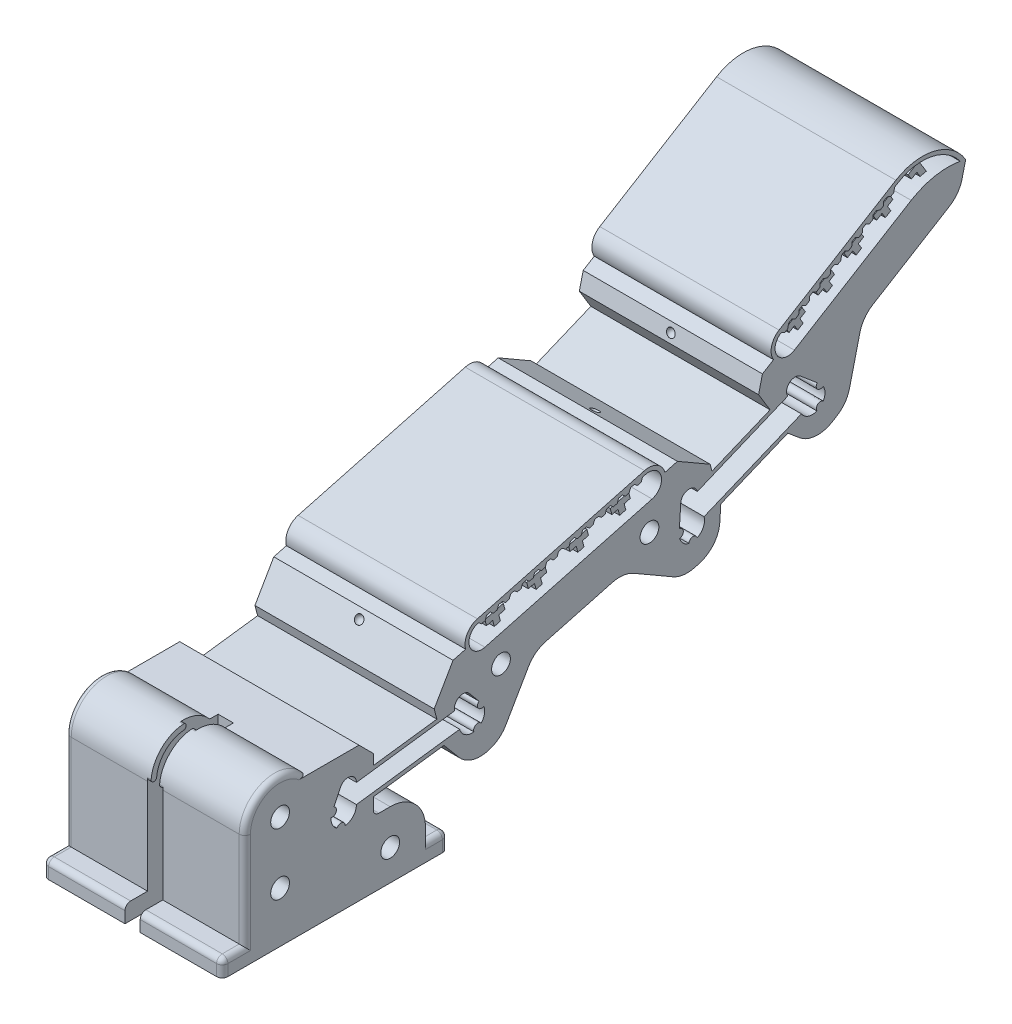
SolidWorks part; units mm, degrees
ref_plane "Front Plane" through (0, 0, 0) normal (0, 0, 1) x (1, 0, 0)
ref_plane "Top Plane" through (0, 0, 0) normal (0, 1, 0) x (1, 0, 0)
ref_plane "Right Plane" through (0, 0, 0) normal (1, 0, 0) x (0, 0, -1)
sketch "values-params_finger" plane through (0, 0, 0) normal (0, 0, 1) x (1, 0, 0)
  line L0 (0, 0) -> (62.5, 0) construction
  line L1 (0, -4.9462) -> (37.5, -4.9462) construction
  line L2 (0, -9.7143) -> (3.36, -9.7143) construction
  line L3 (0, -13.496) -> (4.5602, -13.496) construction
  line L4 (0, -17.4421) -> (12, -17.4421) construction
  line L5 (0, -21.6348) -> (12, -21.6348) construction
  line L6 (0, -25.663) -> (8, -25.663) construction
  line L7 (0, -29.4447) -> (8, -29.4447) construction
  line L8 (0, -32.88) -> (18, -32.88) construction
  line L9 (0, -36.2915) -> (31.75, -36.2915) construction
  line L10 (0, -39.8857) -> (22.75, -39.8857) construction
  line L11 (0, -43.8499) -> (22.75, -43.8499) construction
  line L12 (0, -47.895) -> (4.5, -47.895) construction
  line L13 (0, -51.6975) -> (15, -51.6975) construction
  line L14 (0, -55.9037) -> (15, -55.9037) construction
  line L15 (0, -61.7021) -> (44.45, -61.7021) construction
  dimension "Lp" = 62.5
  dimension "Ld" = 37.5
  dimension "Kp" = 3.36
  dimension "Kd" = 4.5602
  dimension "Kp Length" = 12
  dimension "Kd Length" = 12
  dimension "Rp" = 8
  dimension "Rd" = 8
  dimension "height" = 18
  dimension "depth" = 31.75
  dimension "Lb" = 22.75
  dimension "Lb Pivot" = 22.75
  dimension "pad thickness" = 4.5
  dimension "Tp" = 15
  dimension "Td" = 15
  dimension "base depth" = 44.45
inserted part "params_finger"
sketch "values-params_print" plane through (0, 0, 0) normal (0, 0, 1) x (1, 0, 0)
  line L0 (0, 0) -> (0.7, 0) construction
  line L1 (0, -5.2349) -> (3, -5.2349) construction
  line L2 (0, -10.104) -> (4, -10.104) construction
  line L3 (0, -15.1093) -> (100, -15.1093) construction
  line L4 (0, -19.837) -> (0.15, -19.837) construction
  line L5 (0, -24.2596) -> (0.3, -24.2596) construction
  line L6 (0, -28.606) -> (3.175, -28.606) construction
  line L7 (0, -33.0286) -> (9.5, -33.0286) construction
  line L8 (0, -37.6038) -> (2.4, -37.6038) construction
  line L9 (0, -43.1661) -> (6.35, -43.1661) construction
  dimension "width destroy" = 0.7
  dimension "width keep" = 3
  dimension "width tab" = 4
  dimension "base diameter" = 100
  dimension "print fit" = 0.15
  dimension "print free" = 0.3
  dimension "pin diameter" = 3.175
  dimension "pulley diameter" = 9.5
  dimension "pulley thickness" = 2.4
  dimension "base pin diameter" = 6.35
inserted part "params_print"
sketch "Sketch1" plane through (0, 0, 0) normal (0, 0, 1) x (1, 0, 0)
  line L0 (0, 0) -> (0, 9) construction
  line L1 (0, 0) -> (-15.875, 0) construction
  line L3 (-15.875, 9) -> (15.875, 9)
  line L4 (-15.875, 9) -> (-15.875, -9)
  line L5 (-15.875, -9) -> (15.875, -9)
  line L6 (15.875, 9) -> (15.875, -9)
  dimension "D1" = 31.75
  dimension "D2" = 18
extrude "Base" add sketch "Sketch1" along normal mid plane 22.75
sketch "Sketch3" plane through (15.875, 0, 0) normal (1, 0, 0) x (0, 0, -1)
  line L0 (0, 0) -> (11.375, 0) construction
  line L1 (11.375, -9) -> (11.375, 9) construction
  line L2 (11.375, 0) -> (23.2723, 1.5663) construction
  line L3 (23.2723, 1.5663) -> (72.1508, 14.6632) construction
  line L4 (72.1508, 14.6632) -> (83.2373, 19.2554) construction
  line L5 (83.2373, 19.2554) -> (110.17, 35.7093) construction
  line L6 (17.3237, 0.7832) -> (77.694, 16.9593) construction
  line L7 (77.694, 16.9593) -> (110.17, 35.7093) construction
  line L8 (11.375, 2.4005) -> (22.651, 3.8851)
  line L9 (11.375, -2.4005) -> (23.8936, -0.7524)
  line L10 (20.943, 10.2596) -> (25.6017, -7.127) construction
  line L11 (22.651, 3.8851) -> (20.943, 10.2596)
  line L12 (20.943, 10.2596) -> (69.8214, 23.3566)
  line L13 (23.8936, -0.7524) -> (25.6017, -7.127)
  line L14 (25.6017, -7.127) -> (74.4801, 5.9699)
  line L15 (69.8214, 23.3566) -> (74.4801, 5.9699) construction
  line L16 (81.6646, 21.8297) -> (84.81, 16.6812) construction
  line L17 (74.4801, 5.9699) -> (72.9287, 11.7598)
  line L18 (71.3728, 17.5667) -> (81.6646, 21.8297)
  line L19 (69.8214, 23.3566) -> (71.3728, 17.5667)
  line L20 (72.9287, 11.7598) -> (84.81, 16.6812)
  line L21 (81.6646, 21.8297) -> (78.5453, 26.9356)
  line L22 (78.5453, 26.9356) -> (105.478, 43.3895)
  line L23 (105.478, 43.3895) -> (114.862, 28.0292)
  line L24 (114.862, 28.0292) -> (87.9293, 11.5753)
  line L25 (87.9293, 11.5753) -> (84.81, 16.6812)
  line L26 (11.375, 2.4005) -> (11.375, -2.4005)
  point P9 (17.3237, 0.7832)
  point P10 (77.694, 16.9593)
  dimension "D1" = 12
  dimension "D2" = 12
  dimension "D3" = 15
  dimension "D4" = 15
  dimension "D5" = 62.5
  dimension "D6" = 37.5
  dimension "D7" = 7.5
  dimension "D8" = 7.5
  dimension "D9" = 4.76
  dimension "D10" = 18
  dimension "D11" = 5.9602
  dimension "D12" = 18
extrude "Finger Frame" add sketch "Sketch3" against normal up to surface (31.75 mm away)
sketch "Sketch29" plane through (0, 0, 0) normal (1, 0, 0) x (0, 0, -1)
  line L0 (-11.375, -9) -> (11.375, -9) construction
  line L1 (-11.375, -9) -> (11.375, -9) construction
  line L2 (-11.375, -9) -> (-11.375, -17.1005)
  line L3 (-11.375, -17.1005) -> (20.625, -17.1005)
  line L4 (20.625, -17.1005) -> (20.625, -11.6505)
  line L5 (-11.375, -9) -> (-11.375, -5.4005)
  line L6 (-11.375, -5.4005) -> (14.375, -5.4005)
  line L7 (11.375, -9) -> (11.375, -2.4005) construction
  line L8 (11.375, -9) -> (11.375, -2.4005) construction
  circle A0 centre (14.375, -11.6505) radius 6.25 construction
  circle A1 centre (14.375, -11.6505) radius 4.75 construction
  arc A2 (14.375, -5.4005) -> (20.625, -11.6505) centre (14.375, -11.6505) cw
  dimension "D2" = 9.5
  dimension "D3" = 6.25
  dimension "D4" = 5.45
  dimension "D1" = 32
  dimension "D5" = 3
extrude "Base Reroute" add sketch "Sketch29" along normal up to surface and the other way up to surface
sketch "Sketch2" plane through (15.875, 0, 0) normal (1, 0, 0) x (0, 0, -1)
  line L5 (-11.375, -17.1005) -> (-15.375, -17.1005)
  line L6 (-11.375, -17.1005) -> (-11.375, -14.1005)
  line L7 (-11.375, -14.1005) -> (-15.375, -14.1005)
  line L8 (-15.375, -17.1005) -> (-15.375, -14.1005)
  line L9 (20.625, -17.1005) -> (24.625, -17.1005)
  line L10 (20.625, -17.1005) -> (20.625, -14.1005)
  line L11 (20.625, -14.1005) -> (24.625, -14.1005)
  line L12 (24.625, -17.1005) -> (24.625, -14.1005)
  dimension "D1" = 3
  dimension "D2" = 4
extrude "Base Tabs" add sketch "Sketch2" against normal up to surface (31.75 mm away)
sketch "Sketch4" plane through (15.875, 0, 0) normal (1, 0, 0) x (0, 0, -1)
  line L0 (17.013, 3.1428) -> (17.6343, -1.5765) construction
  line L1 (22.651, 3.8851) -> (11.375, 2.4005) construction
  line L2 (11.375, -2.4005) -> (23.8936, -0.7524) construction
  line L3 (76.7948, 19.0548) -> (78.5933, 14.8639) construction
  line L4 (81.6646, 21.8297) -> (71.3728, 17.5667) construction
  line L5 (82.034, 21.225) -> (84.8057, 22.3731)
  line L6 (81.6646, 21.8297) -> (84.81, 16.6812) construction
  line L7 (71.3728, 17.5667) -> (72.9287, 11.7598) construction
  line L8 (11.375, 2.4005) -> (11.375, -2.4005) construction
  line L9 (22.651, 3.8851) -> (23.8936, -0.7524) construction
  line L10 (11.375, 1.6945) -> (22.8338, 3.2031)
  line L11 (11.375, -1.6945) -> (23.7109, -0.0704)
  line L12 (11.375, 0) -> (23.2723, 1.5663) construction
  line L13 (72.1508, 14.6632) -> (83.2373, 19.2554) construction
  line L14 (71.5555, 16.8847) -> (82.034, 21.225)
  line L15 (72.746, 12.4418) -> (84.4406, 17.2859)
  line L16 (11.375, 1.6945) -> (8.4007, 1.3029)
  line L17 (11.375, -1.6945) -> (8.4007, -2.0861)
  line L18 (5.5407, 1.9358) -> (4.1108, -1.1367)
  line L19 (8.4007, 1.3029) -> (8.4007, -2.0861) construction
  line L20 (28.4068, 4.9462) -> (30.5832, 2.3485)
  line L21 (23.7109, -0.0704) -> (26.6852, 0.3211)
  line L22 (22.8338, 3.2031) -> (25.8081, 3.5947)
  line L23 (71.5555, 16.8847) -> (68.7839, 15.7366)
  line L24 (72.746, 12.4418) -> (69.9743, 11.2938)
  line L25 (65.8378, 15.4405) -> (65.5553, 10.8497)
  line L26 (84.4406, 17.2859) -> (87.2122, 18.4339)
  line L27 (68.7839, 15.7366) -> (69.9743, 11.2938) construction
  line L28 (84.8057, 22.3731) -> (87.2122, 18.4339) construction
  line L29 (87.0523, 24.3021) -> (90.5822, 21.3275)
  arc A0 (8.4007, 1.3029) -> (5.5407, 1.9358) centre (6.9007, 1.3029) ccw
  arc A1 (8.4007, -2.0861) -> (4.1108, -1.1367) centre (6.1507, -2.0861) cw
  arc A2 (25.8081, 3.5947) -> (28.4068, 4.9462) centre (27.257, 3.9829) cw
  arc A3 (26.6852, 0.3211) -> (30.5832, 2.3485) centre (28.8586, 0.9035) ccw
  arc A4 (68.7839, 15.7366) -> (65.8378, 15.4405) centre (67.335, 15.3484) ccw
  arc A5 (69.9743, 11.2938) -> (65.5553, 10.8497) centre (67.801, 10.7114) cw
  arc A6 (84.8057, 22.3731) -> (87.0523, 24.3021) centre (86.0857, 23.1551) cw
  arc A7 (87.2122, 18.4339) -> (90.5822, 21.3275) centre (89.1323, 19.6069) ccw
  dimension "D5" = 1.5
  dimension "D6" = 2.25
  dimension "D1" = 0.7
  dimension "D2" = 0.7
  dimension "D3" = 3
extrude "Flexures" cut sketch "Sketch4" against normal through all
sketch "Sketch5" plane through (15.875, 0, 0) normal (1, 0, 0) x (0, 0, -1)
  line L0 (4.1108, -1.1367) -> (8.4007, -2.0861) construction
  line L1 (6.2557, -1.6114) -> (5.6645, -4.2829) construction
  line L3 (17.1044, 2.4488) -> (17.543, -0.8825) construction
  line L4 (25.8081, 3.5947) -> (8.4007, 1.3029) construction
  line L5 (8.4007, -2.0861) -> (26.6852, 0.3211) construction
  line L6 (69.9743, 11.2938) -> (65.5553, 10.8497) construction
  line L7 (87.2122, 18.4339) -> (90.5822, 21.3275) construction
  line L8 (88.8972, 19.8807) -> (90.598, 17.8999) construction
  line L9 (67.7648, 11.0717) -> (68.026, 8.4727) construction
  arc A0 (4.1108, -1.1367) -> (8.4007, -2.0861) centre (6.1507, -2.0861) ccw construction
  circle A1 centre (5.6645, -4.2829) radius 0.75
  circle A2 centre (4.1108, -1.1367) radius 0.75
  circle A3 centre (29.8968, -1.0927) radius 0.75
  circle A4 centre (30.5832, 2.3485) radius 0.75
  arc A5 (87.2122, 18.4339) -> (90.5822, 21.3275) centre (89.1323, 19.6069) ccw construction
  arc A6 (65.5553, 10.8497) -> (69.9743, 11.2938) centre (67.801, 10.7114) ccw construction
  circle A7 centre (68.026, 8.4727) radius 0.75
  circle A8 centre (65.5553, 10.8497) radius 0.75
  circle A9 centre (90.598, 17.8999) radius 0.75
  circle A10 centre (90.5822, 21.3275) radius 0.75
  dimension "D1" = 1.5
  dimension "D2" = 1.5
extrude "Flexure Anchors" add sketch "Sketch5" against normal up to surface (31.75 mm away)
sketch "Sketch6" plane through (15.875, 0, 0) normal (1, 0, 0) x (0, 0, -1)
  line L0 (22.7126, 3.6551) -> (60.3009, 13.7269) construction
  line L1 (69.8214, 23.3566) -> (20.943, 10.2596) construction
  line L2 (25.6017, -7.127) -> (74.4801, 5.9699) construction
  line L3 (45.3822, 16.8081) -> (50.0409, -0.5786) construction
  line L4 (22.1665, 5.6935) -> (20.943, 10.2596)
  line L5 (33.2091, 5.3055) -> (19.4934, 13.2243) construction
  line L6 (30.1016, 2.9234) -> (28.4068, 4.9462) construction
  line L7 (22.1665, 5.6935) -> (25.5091, 11.4831)
  line L8 (20.943, 10.2596) -> (22.651, 3.8851) construction
  line L9 (20.943, 10.2596) -> (25.5091, 11.4831)
  line L10 (71.0449, 18.7904) -> (69.8214, 23.3566)
  line L11 (69.8214, 23.3566) -> (65.2552, 22.1331)
  line L12 (71.0449, 18.7904) -> (65.2552, 22.1331)
  line L13 (69.8214, 23.3566) -> (78.5453, 26.9356) construction
  line L14 (74.1833, 25.1461) -> (76.5187, 19.6982) construction
  line L15 (81.6646, 21.8297) -> (71.3728, 17.5667) construction
  line L16 (78.5453, 26.9356) -> (79.6251, 25.1682)
  line L17 (78.5453, 26.9356) -> (81.6646, 21.8297) construction
  line L18 (79.6251, 25.1682) -> (80.3127, 28.0154)
  line L19 (105.478, 43.3895) -> (78.5453, 26.9356) construction
  line L20 (80.3127, 28.0154) -> (78.5453, 26.9356)
  line L21 (-11.375, -14.1005) -> (-11.375, 9) construction
  line L22 (-11.375, 9) -> (11.375, 9) construction
  line L23 (-11.375, 2.75) -> (-11.375, 9)
  line L24 (-11.375, 9) -> (-5.125, 9)
  line L25 (17.013, 3.1428) -> (17.543, -0.8825) construction
  line L26 (22.651, 3.8851) -> (11.375, 2.4005) construction
  line L27 (8.4007, -2.0861) -> (26.6852, 0.3211) construction
  line L28 (11.375, 4.2728) -> (11.375, 9)
  line L29 (11.375, 4.2728) -> (6.6478, 9)
  line L30 (11.375, 9) -> (6.6478, 9)
  line L31 (17.278, 1.1302) -> (30.1808, 2.8288) construction
  line L32 (65.6236, 11.9596) -> (89.8102, 21.978) construction
  line L33 (65.8378, 15.4405) -> (65.6013, 11.5982) construction
  line L34 (90.0086, 21.8108) -> (87.0523, 24.3021) construction
  line L35 (69.9743, 11.2938) -> (87.2122, 18.4339) construction
  line L36 (84.8057, 22.3731) -> (68.7839, 15.7366) construction
  line L37 (-5.125, 2.75) -> (-5.125, -8.15) construction
  circle A0 centre (34.0028, 6.6803) radius 1.5875
  circle A1 centre (14.375, -11.6505) radius 1.5875
  circle A2 centre (60.3009, 13.7269) radius 1.5875
  circle A3 centre (-5.125, 2.75) radius 6.25 construction
  circle A4 centre (-5.125, 2.75) radius 4.75 construction
  circle A5 centre (-5.125, 2.75) radius 1.5875
  arc A6 (-5.125, 9) -> (-11.375, 2.75) centre (-5.125, 2.75) ccw
  circle A7 centre (-5.125, -8.15) radius 1.5875
  point P73 (24.7591, 10.1841)
  point P77 (79.9606, 26.5573)
  dimension "D1" = 3.175
  dimension "D2" = 8
  dimension "D5" = 12.5
  dimension "D6" = 3.175
  dimension "D7" = 9.5
  dimension "D11" = 3.175
  dimension "D12" = 3.175
  dimension "D3" = 45
  dimension "D4" = 1.5
  dimension "D8" = 1.5
  dimension "D9" = 8
  dimension "D10" = 6.8375
  dimension "D13" = 10.9
extrude "Pin Holes" cut sketch "Sketch6" against normal through all
sketch "Sketch8" plane through (0, -8.175, -14.1595) normal (0, 0.5, 0.866) x (1, 0, 0)
  line L0 (0, 22.6992) -> (0, 16.0139) construction
  line L1 (15.875, 22.6992) -> (-15.875, 22.6992) construction
  line L2 (-15.875, 16.0139) -> (15.875, 16.0139) construction
  circle A0 centre (0, 21.1992) radius 0.75
  dimension "D1" = 1.5
  dimension "D2" = 1.5
extrude "Tendon Route 1" cut sketch "Sketch8" against normal blind 0.75
sketch "Sketch9" plane through (0, -16.784, -69.4927) normal (0, 0.2348, 0.9721) x (1, 0, 0)
  line L0 (0, 46.0875) -> (0, 43.1584) construction
  line L1 (15.875, 46.0875) -> (-15.875, 46.0875) construction
  line L2 (-15.875, 43.1584) -> (15.875, 43.1584) construction
  circle A0 centre (0, 44.5875) radius 0.75
  dimension "D1" = 1.5
  dimension "D2" = 1.5
extrude "Tendon Route 2" cut sketch "Sketch9" against normal blind 0.75
sketch "Sketch10" plane through (0, 44.8562, -25.8977) normal (0, 0.866, -0.5) x (1, 0, 0)
  line L0 (0, 45.4462) -> (0, 52.1315) construction
  line L1 (-15.875, 45.4462) -> (15.875, 45.4462) construction
  line L2 (15.875, 52.1315) -> (-15.875, 52.1315) construction
  circle A0 centre (0, 46.9462) radius 0.75
  dimension "D1" = 1.5
  dimension "D2" = 1.5
extrude "Tendon Route 3" cut sketch "Sketch10" against normal blind 0.75
sketch "Sketch11" plane through (15.875, 0, 0) normal (1, 0, 0) x (0, 0, -1)
  line L0 (-0.3647, 6.8) -> (-5.125, 6.8) construction
  line L1 (11.375, 9) -> (-5.125, 9)
  line L2 (11.375, 9) -> (11.375, 6.8)
  line L3 (11.375, 6.8) -> (-0.3647, 6.8)
  line L5 (11.375, 2.4005) -> (11.375, 4.2728) construction
  line L6 (-5.125, 9) -> (6.6478, 9) construction
  circle A0 centre (-5.125, 2.75) radius 4.75 construction
  circle A1 centre (-5.125, 2.75) radius 4.05 construction
  arc A2 (-5.125, 9) -> (-0.3647, 6.8) centre (-5.125, 2.75) cw
  dimension "D1" = 9.5
  dimension "D2" = 0.7
extrude "Tendon Clearance" cut sketch "Sketch11" against normal through all
fillet "Tendon Route Ports" radius 0.75 3 edges at (0, 21.1086, -65.5298) (0, 25.6522, -80.5135) (0, 9.1596, -25.0336)
sketch "Sketch13" plane through (15.875, 0, 0) normal (1, 0, 0) x (0, 0, -1)
  line L0 (29.8167, 15.6914) -> (59.4206, 23.6238)
  line L1 (65.2552, 22.1331) -> (25.5091, 11.4831) construction
  line L2 (27.7307, 12.0784) -> (63.0336, 21.5378)
  line L3 (83.2549, 33.2698) -> (103.94, 45.9069)
  line L4 (105.478, 43.3895) -> (80.3127, 28.0154) construction
  line L5 (29.8167, 15.6914) -> (30.5802, 12.8419) construction
  line L6 (83.2549, 33.2698) -> (84.7928, 30.7524) construction
  line L7 (114.862, 28.0292) -> (105.478, 43.3895) construction
  line L8 (82.2755, 29.2145) -> (105.478, 43.3895)
  line L9 (105.478, 43.3895) -> (113.3241, 30.5466)
  arc A0 (27.7307, 12.0784) -> (29.8167, 15.6914) centre (30.5802, 12.8419) cw
  arc A1 (63.0336, 21.5378) -> (59.4206, 23.6238) centre (60.1841, 20.7743) ccw
  arc A2 (82.2755, 29.2145) -> (83.2549, 33.2698) centre (84.7928, 30.7524) cw
  arc A3 (103.94, 45.9069) -> (113.3241, 30.5466) centre (108.632, 38.2267) cw
  dimension "D2" = 9
  dimension "D1" = 2.95
  dimension "D3" = 2.3
  dimension "D4" = 2.3
  dimension "D5" = 2.3
extrude "Finger Pad Outline" add sketch "Sketch13" against normal up to surface (31.75 mm away)
sketch "Sketch12" plane through (15.875, 0, 0) normal (1, 0, 0) x (0, 0, -1)
  line L0 (23.8936, -0.7524) -> (28.5685, -6.3321)
  line L1 (25.6017, -7.127) -> (74.4801, 5.9699) construction
  line L2 (72.9287, 11.7598) -> (72.5404, 5.4502)
  line L3 (84.81, 16.6812) -> (89.6335, 12.6164)
  line L4 (87.9293, 11.5753) -> (114.862, 28.0292) construction
  line L5 (90.0086, 21.8108) -> (87.0523, 24.3021) construction
  line L6 (65.8378, 15.4405) -> (65.6013, 11.5982) construction
  line L7 (30.1016, 2.9234) -> (28.4068, 4.9462) construction
  line L8 (23.8936, -0.7524) -> (25.6017, -7.127)
  line L9 (25.6017, -7.127) -> (28.5685, -6.3321)
  line L10 (72.9287, 11.7598) -> (74.4801, 5.9699)
  line L11 (74.4801, 5.9699) -> (72.5404, 5.4502)
  line L12 (84.81, 16.6812) -> (87.9293, 11.5753)
  line L13 (87.9293, 11.5753) -> (89.6335, 12.6164)
  line L14 (25.8081, 3.5947) -> (26.6852, 0.3211) construction
  line L15 (68.7839, 15.7366) -> (69.9743, 11.2938) construction
  line L16 (26.2467, 1.9579) -> (69.3791, 13.5152) construction
  line L17 (59.4206, 23.6238) -> (29.8167, 15.6914) construction
  line L18 (55.7266, 9.857) -> (69.3791, 13.5152) construction
  line L19 (44.6187, 19.6576) -> (50.0409, -0.5786) construction
  line L20 (86.0089, 20.4035) -> (98.0703, 27.7721) construction
  line L21 (95.2366, 16.0395) -> (98.0703, 27.7721)
  line L22 (33.8121, -4.9271) -> (39.8992, 5.6161)
  line L23 (22.1665, 5.6935) -> (25.5091, 11.4831) construction
  line L24 (39.8992, 5.6161) -> (55.7266, 9.857)
  line L25 (33.8121, -4.9271) -> (66.2698, 3.77)
  line L26 (66.2698, 3.77) -> (55.7266, 9.857)
  line L27 (28.5685, -6.3321) -> (33.8121, -4.9271) construction
  line L28 (98.0703, 27.7721) -> (115.1783, 38.2238)
  line L29 (116.3122, 42.9188) -> (122.5422, 32.7212)
  line L30 (122.5422, 32.7212) -> (95.2366, 16.0395)
  line L31 (115.1783, 38.2238) -> (116.3122, 42.9188)
  line L32 (79.6251, 25.1682) -> (80.3127, 28.0154) construction
  line L33 (84.8057, 22.3731) -> (87.2122, 18.4339) construction
  line L34 (86.0089, 20.4035) -> (118.0927, 40.0043) construction
  arc A1 (113.3241, 30.5466) -> (103.94, 45.9069) centre (108.632, 38.2267) ccw construction
  point P51 (47.8129, 7.7365)
  dimension "D1" = 8.5
extrude "Finger Outline" cut sketch "Sketch12" against normal through all
sketch "Sketch14" plane through (15.875, 0, 0) normal (1, 0, 0) x (0, 0, -1)
  line L1 (44.6187, 19.6576) -> (47.8129, 7.7365) construction
  line L2 (59.4206, 23.6238) -> (29.8167, 15.6914) construction
  line L3 (55.7266, 9.857) -> (39.8992, 5.6161) construction
  line L5 (29.9979, 15.0153) -> (59.6018, 22.9476)
  line L6 (31.1626, 10.6686) -> (60.7665, 18.601)
  line L7 (103.94, 45.9069) -> (106.651, 41.4695) construction
  line L8 (116.3122, 42.9188) -> (90.0462, 26.8721) construction
  line L9 (103.94, 45.9069) -> (83.2549, 33.2698) construction
  line L10 (83.6198, 32.6725) -> (104.305, 45.3096)
  line L11 (85.9658, 28.8324) -> (106.651, 41.4695)
  circle A0 centre (30.5802, 12.8419) radius 2.25 construction
  circle A2 centre (60.1841, 20.7743) radius 2.25 construction
  arc A3 (29.9979, 15.0153) -> (31.1626, 10.6686) centre (30.5802, 12.8419) ccw
  arc A4 (59.6018, 22.9476) -> (60.7665, 18.601) centre (60.1841, 20.7743) cw
  circle A5 centre (84.7928, 30.7524) radius 2.25 construction
  arc A7 (83.6198, 32.6725) -> (85.9658, 28.8324) centre (84.7928, 30.7524) ccw
  arc A8 (104.305, 45.3096) -> (115.3247, 43.1358) centre (108.632, 38.2267) cw
  arc A9 (106.651, 41.4695) -> (115.3247, 43.1358) centre (113.2105, 30.7324) cw
  arc A12 (29.8167, 15.6914) -> (27.7307, 12.0784) centre (30.5802, 12.8419) ccw construction
  arc A13 (29.8167, 15.6914) -> (27.7307, 12.0784) centre (30.5802, 12.8419) ccw construction
  dimension "D1" = 0.7
  dimension "D2" = 0.7
extrude "Finger Pad Cavity" cut sketch "Sketch14" against normal through all and the other way through all contours A4 L5 A3 L6 | L11 A9 A8 L10 A7
sketch "Sketch15" plane through (0, 0, 0) normal (1, 0, 0) x (0, 0, -1)
  line L0 (33.592, 8.2137) -> (59.89, 15.2603)
  line L1 (69.9743, 11.2938) -> (68.7839, 15.7366) construction
  line L2 (32.7024, 5.7698) -> (36.6955, 0.0671)
  line L3 (39.8992, 5.6161) -> (33.8121, -4.9271) construction
  line L5 (46.741, 11.737) -> (48.9855, 3.3602) construction
  line L6 (61.8823, 13.5885) -> (61.2756, 6.6533)
  line L7 (36.6955, 0.0671) -> (61.2756, 6.6533)
  line L8 (89.759, 26.8954) -> (96.5502, 21.4783)
  line L9 (89.9213, 29.4911) -> (110.3842, 41.9924)
  line L10 (110.3842, 41.9924) -> (118.9477, 35.1615)
  line L11 (118.9477, 35.1615) -> (96.5502, 21.4783)
  line L12 (98.0703, 27.7721) -> (95.2366, 16.0395) construction
  line L13 (106.651, 41.4695) -> (85.9658, 28.8324) construction
  line L14 (84.8057, 22.3731) -> (87.2122, 18.4339) construction
  line L17 (69.3791, 13.5152) -> (86.0089, 20.4035) construction
  line L18 (69.3791, 13.5152) -> (61.8823, 13.5885) construction
  line L19 (86.0089, 20.4035) -> (89.759, 26.8954) construction
  circle A0 centre (34.0028, 6.6803) radius 1.5875 construction
  circle A1 centre (60.3009, 13.7269) radius 1.5875 construction
  arc A3 (33.592, 8.2137) -> (32.7024, 5.7698) centre (34.0028, 6.6803) ccw
  arc A4 (59.89, 15.2603) -> (61.8823, 13.5885) centre (60.3009, 13.7269) cw
  arc A5 (89.9213, 29.4911) -> (89.759, 26.8954) centre (90.7489, 28.1364) ccw
  circle A6 centre (34.0028, 6.6803) radius 1.5875 construction
  dimension "D2" = 1.5
  dimension "D3" = 70
  dimension "D4" = 6
  dimension "D5" = 70
extrude "Back Cutaway" cut sketch "Sketch15" against normal mid plane 25.75
sketch "Sketch7" plane through (0, -17.1005, 0) normal (0, 1, 0) x (1, 0, 0)
  line L0 (0, 0) -> (0, -5.125) construction
  line L1 (15.875, -6.7125) -> (15.875, -3.5375) construction
  line L4 (-1.2, 1.125) -> (1.2, 1.125)
  line L5 (-1.2, 1.125) -> (-1.2, -15.375)
  line L6 (-1.2, -15.375) -> (1.2, -15.375)
  line L7 (1.2, 1.125) -> (1.2, -15.375)
  line L8 (0, -5.125) -> (15.875, -5.125) construction
  dimension "D1" = 2.4
  dimension "D2" = 6.25
  dimension "D3" = 10.25
extrude "Pulley Clearance 1" cut sketch "Sketch7" along normal through all
sketch "Sketch30" plane through (0, -17.1005, 0) normal (0, -1, 0) x (1, 0, 0)
  line L0 (-15.875, -24.625) -> (15.875, -24.625) construction
  line L1 (-1.2, -1.125) -> (1.2, -1.125)
  line L2 (-1.2, -1.125) -> (-1.2, -24.625)
  line L3 (-1.2, -24.625) -> (1.2, -24.625)
  line L4 (1.2, -1.125) -> (1.2, -24.625)
  line L5 (1.2, -1.125) -> (1.2, 15.375) construction
extrude "Pulley Clearance 2" cut sketch "Sketch30" against normal up to surface (11.7 mm away)
sketch "Sketch16" plane through (15.875, 0, 0) normal (1, 0, 0) x (0, 0, -1)
  line L0 (-11.375, 2.75) -> (-5.125, 2.75) construction
  line L1 (-5.125, 2.75) -> (-5.125, 9) construction
  line L2 (-11.375, 2.75) -> (-10.375, 2.75)
  line L3 (-5.125, 9) -> (-5.125, 8)
  line L4 (14.375, -5.4005) -> (14.375, -11.6505) construction
  line L5 (14.375, -11.6505) -> (20.625, -11.6505) construction
  line L6 (14.375, -5.4005) -> (14.375, -6.4005)
  line L7 (19.625, -11.6505) -> (20.625, -11.6505)
  arc A0 (-11.375, 2.75) -> (-5.125, 9) centre (-5.125, 2.75) cw
  arc A1 (-0.3647, 6.8) -> (-11.375, 2.75) centre (-5.125, 2.75) ccw construction
  arc A2 (-5.125, 8) -> (-10.375, 2.75) centre (-5.125, 2.75) ccw
  arc A3 (20.625, -11.6505) -> (14.375, -5.4005) centre (14.375, -11.6505) ccw construction
  arc A4 (20.625, -11.6505) -> (14.375, -5.4005) centre (14.375, -11.6505) ccw
  arc A5 (14.375, -6.4005) -> (19.625, -11.6505) centre (14.375, -11.6505) cw
  dimension "D1" = 1
  dimension "D2" = 1
extrude "Pulley Cover" add sketch "Sketch16" against normal up to surface (31.75 mm away)
sketch "Sketch17" plane through (0, -17.1005, 0) normal (0, -1, 0) x (1, 0, 0)
  line L0 (0, 0) -> (0, 24.5637) construction
  line L1 (-1.2, -1.125) -> (1.2, -1.125) construction
  line L3 (-1.2, -1.125) -> (1.2, -1.125) construction
  line L4 (-15.875, 15.375) -> (-1.2, 15.375) construction
  line L5 (-0.75, -1.125) -> (0.75, -1.125)
  line L6 (-0.75, -1.125) -> (-0.75, 15.375)
  line L7 (-0.75, 15.375) -> (0.75, 15.375)
  line L8 (0.75, -1.125) -> (0.75, 15.375)
  line L9 (1.2, 15.375) -> (15.875, 15.375) construction
  line L10 (-15.875, 15.375) -> (-1.2, 15.375) construction
  line L11 (1.2, 15.375) -> (15.875, 15.375) construction
  dimension "D1" = 1.5
extrude "Pulley Cover Cutaway 1" cut sketch "Sketch17" against normal through all
sketch "Sketch31" plane through (0, -17.1005, 0) normal (0, -1, 0) x (1, 0, 0)
  line L0 (-1.2, -20.625) -> (1.2, -20.625) construction
  line L1 (-1.2, -14.375) -> (1.2, -14.375) construction
  line L2 (-1.2, -20.625) -> (1.2, -20.625) construction
  line L3 (-1.2, -14.375) -> (1.2, -14.375) construction
  line L4 (0, -20.625) -> (0, -14.375) construction
  line L6 (0.75, -20.625) -> (-0.75, -20.625)
  line L7 (0.75, -20.625) -> (0.75, -14.375)
  line L8 (0.75, -14.375) -> (-0.75, -14.375)
  line L9 (-0.75, -20.625) -> (-0.75, -14.375)
  dimension "D1" = 1.5
extrude "Pulley Cover Cutaway 2" cut sketch "Sketch31" against normal up to surface (11.7 mm away)
sketch "Sketch18" plane through (0, 0, 0) normal (1, 0, 0) x (0, 0, -1)
  line L0 (60.7665, 18.601) -> (31.1626, 10.6686) construction
  line L1 (60.7665, 18.601) -> (31.1626, 10.6686) construction
  line L2 (59.6018, 22.9476) -> (29.9979, 15.0153) construction
  line L3 (59.6018, 22.9476) -> (29.9979, 15.0153) construction
  line L4 (44.7998, 18.9814) -> (45.9645, 14.6348) construction
  line L5 (34.5719, 12.7468) -> (34.2807, 13.8335) construction
  line L6 (29.9979, 15.0153) -> (31.1626, 10.6686) construction
  line L7 (30.5802, 12.8419) -> (45.3822, 16.8081) construction
  line L8 (37.9812, 14.825) -> (38.5635, 12.6517) construction
  line L9 (32.6507, 13.3967) -> (32.9419, 12.3101)
  line L10 (32.9419, 12.3101) -> (34.0285, 12.6012)
  line L11 (34.0285, 12.6012) -> (34.3197, 11.5146)
  line L12 (34.3197, 11.5146) -> (35.4064, 11.8057)
  line L13 (40.3429, 14.2931) -> (40.0517, 15.3798)
  line L14 (35.4064, 11.8057) -> (35.1152, 12.8924)
  line L15 (35.1152, 12.8924) -> (36.2019, 13.1836)
  line L16 (36.2019, 13.1836) -> (35.9107, 14.2702)
  line L17 (35.9107, 14.2702) -> (32.6507, 13.3967)
  line L18 (38.2724, 13.7384) -> (30.8714, 11.7553) construction
  line L19 (41.4295, 14.5843) -> (40.3429, 14.2931)
  line L20 (41.7207, 13.4977) -> (41.4295, 14.5843)
  line L21 (42.8074, 13.7888) -> (41.7207, 13.4977)
  line L22 (42.5162, 14.8755) -> (42.8074, 13.7888)
  line L23 (43.6029, 15.1667) -> (42.5162, 14.8755)
  line L24 (43.3117, 16.2533) -> (43.6029, 15.1667)
  line L25 (40.0517, 15.3798) -> (43.3117, 16.2533)
  line L26 (47.7438, 16.2762) -> (48.8305, 16.5674)
  line L27 (48.8305, 16.5674) -> (49.1217, 15.4807)
  line L28 (49.1217, 15.4807) -> (50.2083, 15.7719)
  line L29 (50.2083, 15.7719) -> (49.9172, 16.8586)
  line L30 (49.9172, 16.8586) -> (51.0038, 17.1497)
  line L31 (47.4527, 17.3629) -> (47.7438, 16.2762)
  line L32 (50.7127, 18.2364) -> (47.4527, 17.3629)
  line L33 (51.0038, 17.1497) -> (50.7127, 18.2364)
  line L34 (57.6093, 17.755) -> (56.5226, 17.4638)
  line L35 (56.2315, 18.5505) -> (55.1448, 18.2593)
  line L36 (56.5226, 17.4638) -> (56.2315, 18.5505)
  line L37 (57.3181, 18.8417) -> (57.6093, 17.755)
  line L38 (58.4048, 19.1328) -> (57.3181, 18.8417)
  line L39 (55.1448, 18.2593) -> (54.8536, 19.346)
  line L40 (54.8536, 19.346) -> (58.1136, 20.2195)
  line L41 (58.1136, 20.2195) -> (58.4048, 19.1328)
  line L42 (106.651, 41.4695) -> (85.9658, 28.8324) construction
  line L43 (104.305, 45.3096) -> (83.6198, 32.6725) construction
  line L44 (106.651, 41.4695) -> (85.9658, 28.8324) construction
  line L45 (104.305, 45.3096) -> (83.6198, 32.6725) construction
  line L46 (83.6198, 32.6725) -> (85.9658, 28.8324) construction
  line L47 (93.9624, 38.991) -> (96.3084, 35.1509) construction
  line L48 (84.7928, 30.7524) -> (95.1354, 37.071) construction
  line L49 (89.9641, 33.9117) -> (91.1371, 31.9916) construction
  line L50 (90.5506, 32.9517) -> (85.3793, 29.7924) construction
  line L51 (87.965, 31.372) -> (87.3785, 32.332) construction
  line L52 (113.2105, 30.7324) -> (110.8368, 43.0887) construction
  line L53 (110.8368, 43.0887) -> (109.4827, 45.3052)
  line L54 (85.9384, 31.4523) -> (88.8185, 33.2118)
  line L55 (88.8185, 33.2118) -> (89.405, 32.2518)
  line L56 (89.405, 32.2518) -> (88.445, 31.6653)
  line L57 (88.445, 31.6653) -> (89.0315, 30.7053)
  line L58 (89.0315, 30.7053) -> (88.0715, 30.1188)
  line L59 (88.0715, 30.1188) -> (87.485, 31.0788)
  line L60 (87.485, 31.0788) -> (86.525, 30.4923)
  line L61 (86.525, 30.4923) -> (85.9384, 31.4523)
  line L62 (91.6962, 33.6515) -> (92.6563, 34.2381)
  line L63 (92.6563, 34.2381) -> (93.2428, 33.278)
  line L64 (93.2428, 33.278) -> (94.2028, 33.8645)
  line L65 (94.2028, 33.8645) -> (93.6163, 34.8246)
  line L66 (93.6163, 34.8246) -> (94.5763, 35.4111)
  line L67 (91.1097, 34.6116) -> (91.6962, 33.6515)
  line L68 (93.9898, 36.3711) -> (91.1097, 34.6116)
  line L69 (94.5763, 35.4111) -> (93.9898, 36.3711)
  line L70 (101.4523, 40.9301) -> (102.0388, 39.9701)
  line L71 (102.0388, 39.9701) -> (102.9988, 40.5566)
  line L72 (102.9988, 40.5566) -> (103.5853, 39.5966)
  line L73 (103.5853, 39.5966) -> (104.5453, 40.1831)
  line L74 (104.5453, 40.1831) -> (103.9588, 41.1431)
  line L75 (103.9588, 41.1431) -> (104.9189, 41.7296)
  line L76 (104.9189, 41.7296) -> (104.3324, 42.6896)
  line L77 (104.3324, 42.6896) -> (101.4523, 40.9301)
  line L78 (96.8675, 36.8108) -> (96.281, 37.7708)
  line L79 (97.8275, 37.3973) -> (96.8675, 36.8108)
  line L80 (98.414, 36.4373) -> (97.8275, 37.3973)
  line L81 (99.3741, 37.0238) -> (98.414, 36.4373)
  line L82 (98.7876, 37.9838) -> (99.3741, 37.0238)
  line L83 (99.7476, 38.5703) -> (98.7876, 37.9838)
  line L84 (99.1611, 39.5304) -> (99.7476, 38.5703)
  line L85 (96.281, 37.7708) -> (99.1611, 39.5304)
  line L86 (109.4827, 45.3052) -> (107.6096, 44.1608)
  line L87 (107.6096, 44.1608) -> (108.1961, 43.2008)
  line L88 (108.1961, 43.2008) -> (109.1561, 43.7873)
  line L89 (109.1561, 43.7873) -> (109.7426, 42.8273)
  line L90 (109.7426, 42.8273) -> (110.8368, 43.0887)
  arc A0 (115.3247, 43.1358) -> (106.651, 41.4695) centre (113.2105, 30.7324) ccw construction
  arc A1 (115.3247, 43.1358) -> (106.651, 41.4695) centre (113.2105, 30.7324) ccw construction
extrude "Pad Hooks" add sketch "Sketch18" along normal mid plane 28.75
sketch "Sketch19" plane through (15.875, 0, 0) normal (1, 0, 0) x (0, 0, -1)
  line L0 (29.8167, 15.6914) -> (29.9979, 15.0153) construction
  line L1 (29.9979, 15.0153) -> (30.5329, 14.5639)
  line L2 (30.5329, 14.5639) -> (31.2091, 14.7451)
  line L3 (86.7772, 34.6014) -> (85.4972, 33.8194)
  line L4 (31.2091, 14.7451) -> (31.4468, 15.4035)
  line L5 (59.6018, 22.9476) -> (29.9979, 15.0153) construction
  line L6 (31.4468, 15.4035) -> (29.9979, 15.0153)
  line L7 (33.5718, 15.9729) -> (32.1229, 15.5847)
  line L8 (32.1229, 15.5847) -> (32.658, 15.1333)
  line L9 (32.658, 15.1333) -> (33.3341, 15.3145)
  line L10 (33.3341, 15.3145) -> (33.5718, 15.9729)
  line L11 (35.6968, 16.5423) -> (34.248, 16.1541)
  line L12 (34.248, 16.1541) -> (34.783, 15.7027)
  line L13 (34.783, 15.7027) -> (35.4592, 15.8839)
  line L14 (35.4592, 15.8839) -> (35.6968, 16.5423)
  line L15 (37.8219, 17.1117) -> (36.373, 16.7235)
  line L16 (36.373, 16.7235) -> (36.908, 16.2721)
  line L17 (36.908, 16.2721) -> (37.5842, 16.4533)
  line L18 (37.5842, 16.4533) -> (37.8219, 17.1117)
  line L19 (39.9469, 17.6811) -> (38.498, 17.2929)
  line L20 (38.498, 17.2929) -> (39.0331, 16.8415)
  line L21 (39.0331, 16.8415) -> (39.7092, 17.0227)
  line L22 (39.7092, 17.0227) -> (39.9469, 17.6811)
  line L23 (42.072, 18.2505) -> (40.6231, 17.8623)
  line L24 (40.6231, 17.8623) -> (41.1581, 17.4109)
  line L25 (41.1581, 17.4109) -> (41.8343, 17.5921)
  line L26 (41.8343, 17.5921) -> (42.072, 18.2505)
  line L27 (44.197, 18.8199) -> (42.7481, 18.4317)
  line L28 (42.7481, 18.4317) -> (43.2832, 17.9803)
  line L29 (43.2832, 17.9803) -> (43.9593, 18.1615)
  line L30 (43.9593, 18.1615) -> (44.197, 18.8199)
  line L31 (46.322, 19.3893) -> (44.8731, 19.0011)
  line L32 (44.8731, 19.0011) -> (45.4082, 18.5497)
  line L33 (45.4082, 18.5497) -> (46.0843, 18.7309)
  line L34 (46.0843, 18.7309) -> (46.322, 19.3893)
  line L35 (48.4471, 19.9587) -> (46.9982, 19.5705)
  line L36 (46.9982, 19.5705) -> (47.5332, 19.1191)
  line L37 (47.5332, 19.1191) -> (48.2094, 19.3003)
  line L38 (48.2094, 19.3003) -> (48.4471, 19.9587)
  line L39 (50.5721, 20.5281) -> (49.1232, 20.1399)
  line L40 (49.1232, 20.1399) -> (49.6583, 19.6885)
  line L41 (49.6583, 19.6885) -> (50.3344, 19.8697)
  line L42 (50.3344, 19.8697) -> (50.5721, 20.5281)
  line L43 (52.6971, 21.0975) -> (51.2482, 20.7093)
  line L44 (51.2482, 20.7093) -> (51.7833, 20.2579)
  line L45 (51.7833, 20.2579) -> (52.4594, 20.4391)
  line L46 (52.4594, 20.4391) -> (52.6971, 21.0975)
  line L47 (54.8222, 21.6669) -> (53.3733, 21.2787)
  line L48 (53.3733, 21.2787) -> (53.9083, 20.8273)
  line L49 (53.9083, 20.8273) -> (54.5845, 21.0085)
  line L50 (54.5845, 21.0085) -> (54.8222, 21.6669)
  line L67 (83.2549, 33.2698) -> (83.6198, 32.6725) construction
  line L68 (83.6198, 32.6725) -> (84.2607, 32.3908)
  line L69 (84.2607, 32.3908) -> (84.858, 32.7557)
  line L70 (84.858, 32.7557) -> (84.8999, 33.4545)
  line L71 (104.305, 45.3096) -> (83.6198, 32.6725) construction
  line L72 (84.8999, 33.4545) -> (83.6198, 32.6725)
  line L73 (85.4972, 33.8194) -> (86.138, 33.5377)
  line L74 (86.138, 33.5377) -> (86.7354, 33.9026)
  line L75 (86.7354, 33.9026) -> (86.7772, 34.6014)
  line L76 (88.6546, 35.7483) -> (87.3746, 34.9663)
  line L77 (87.3746, 34.9663) -> (88.0154, 34.6846)
  line L78 (88.0154, 34.6846) -> (88.6128, 35.0496)
  line L79 (88.6128, 35.0496) -> (88.6546, 35.7483)
  line L80 (90.532, 36.8953) -> (89.252, 36.1133)
  line L81 (89.252, 36.1133) -> (89.8928, 35.8316)
  line L82 (89.8928, 35.8316) -> (90.4901, 36.1965)
  line L83 (90.4901, 36.1965) -> (90.532, 36.8953)
  line L84 (92.4094, 38.0422) -> (91.1293, 37.2602)
  line L85 (91.1293, 37.2602) -> (91.7702, 36.9785)
  line L86 (91.7702, 36.9785) -> (92.3675, 37.3435)
  line L87 (92.3675, 37.3435) -> (92.4094, 38.0422)
  line L88 (94.2867, 39.1891) -> (93.0067, 38.4071)
  line L89 (93.0067, 38.4071) -> (93.6475, 38.1255)
  line L90 (93.6475, 38.1255) -> (94.2449, 38.4904)
  line L91 (94.2449, 38.4904) -> (94.2867, 39.1891)
  line L92 (96.1641, 40.3361) -> (94.8841, 39.5541)
  line L93 (94.8841, 39.5541) -> (95.5249, 39.2724)
  line L94 (95.5249, 39.2724) -> (96.1222, 39.6373)
  line L95 (96.1222, 39.6373) -> (96.1641, 40.3361)
  line L96 (98.0415, 41.483) -> (96.7615, 40.701)
  line L97 (96.7615, 40.701) -> (97.4023, 40.4193)
  line L98 (97.4023, 40.4193) -> (97.9996, 40.7843)
  line L99 (97.9996, 40.7843) -> (98.0415, 41.483)
  line L100 (99.9189, 42.63) -> (98.6388, 41.848)
  line L101 (98.6388, 41.848) -> (99.2796, 41.5663)
  line L102 (99.2796, 41.5663) -> (99.877, 41.9312)
  line L103 (99.877, 41.9312) -> (99.9189, 42.63)
  line L104 (101.7962, 43.7769) -> (100.5162, 42.9949)
  line L105 (100.5162, 42.9949) -> (101.157, 42.7132)
  line L106 (101.157, 42.7132) -> (101.7544, 43.0782)
  line L107 (101.7544, 43.0782) -> (101.7962, 43.7769)
  line L108 (103.6736, 44.9238) -> (102.3936, 44.1418)
  line L109 (102.3936, 44.1418) -> (103.0344, 43.8602)
  line L110 (103.0344, 43.8602) -> (103.6317, 44.2251)
  line L111 (103.6317, 44.2251) -> (103.6736, 44.9238)
  line L128 (56.9472, 22.2363) -> (55.4983, 21.8481)
  line L129 (55.4983, 21.8481) -> (56.0334, 21.3967)
  line L130 (56.0334, 21.3967) -> (56.7095, 21.5779)
  line L131 (56.7095, 21.5779) -> (56.9472, 22.2363)
  line L132 (59.0722, 22.8057) -> (57.6234, 22.4175)
  line L133 (57.6234, 22.4175) -> (58.1584, 21.9661)
  line L134 (58.1584, 21.9661) -> (58.8346, 22.1473)
  line L135 (58.8346, 22.1473) -> (59.0722, 22.8057)
  dimension "D1" = 1.5
  dimension "D3" = 0.7
  dimension "D2" = 0.7
  dimension "D4" = 1.5
  dimension "D5" = 14
  dimension "D6" = 11
extrude "Ridges" add sketch "Sketch19" against normal up to surface (31.75 mm away)
sketch "Sketch25" plane through (0, 0, 0) normal (1, 0, 0) x (0, 0, -1)
  line L24 (20.625, -11.6505) -> (19.625, -11.6505)
  line L25 (14.375, -6.4005) -> (14.375, -5.4005)
  line L26 (14.375, -5.4005) -> (11.375, -5.4005)
  line L27 (11.375, -5.4005) -> (1.125, -5.4005)
  line L28 (1.125, -5.4005) -> (1.125, 6.8)
  line L29 (1.125, 6.8) -> (-0.3647, 6.8)
  line L30 (-5.125, 9) -> (-5.125, 8)
  line L31 (-10.375, 2.75) -> (-11.375, 2.75)
  line L32 (-11.375, 2.75) -> (-11.375, -14.1005)
  line L33 (-11.375, -14.1005) -> (-15.375, -14.1005)
  line L34 (-15.375, -14.1005) -> (-15.375, -17.1005)
  line L35 (-15.375, -17.1005) -> (24.625, -17.1005)
  line L36 (24.625, -17.1005) -> (24.625, -14.1005)
  line L37 (24.625, -14.1005) -> (20.625, -14.1005)
  line L38 (20.625, -14.1005) -> (20.625, -11.6505)
  line L39 (20.625, -11.6505) -> (19.625, -11.6505)
  line L40 (14.375, -6.4005) -> (14.375, -5.4005)
  line L41 (14.375, -5.4005) -> (11.375, -5.4005)
  line L42 (11.375, -5.4005) -> (1.125, -5.4005)
  line L43 (1.125, -5.4005) -> (1.125, 6.8)
  line L44 (1.125, 6.8) -> (-0.3647, 6.8)
  line L45 (-5.125, 9) -> (-5.125, 8)
  line L46 (-10.375, 2.75) -> (-11.375, 2.75)
  line L47 (-11.375, 2.75) -> (-11.375, -14.1005)
  line L48 (-11.375, -14.1005) -> (-15.375, -14.1005)
  line L49 (-15.375, -14.1005) -> (-15.375, -17.1005)
  line L50 (-15.375, -17.1005) -> (24.625, -17.1005)
  line L51 (24.625, -17.1005) -> (24.625, -14.1005)
  line L52 (24.625, -14.1005) -> (20.625, -14.1005)
  line L53 (20.625, -14.1005) -> (20.625, -11.6505)
  arc A6 (19.625, -11.6505) -> (14.375, -6.4005) centre (14.375, -11.6505) ccw
  arc A7 (-0.3647, 6.8) -> (-5.125, 9) centre (-5.125, 2.75) ccw
  arc A8 (-5.125, 8) -> (-10.375, 2.75) centre (-5.125, 2.75) ccw
  arc A9 (19.625, -11.6505) -> (14.375, -6.4005) centre (14.375, -11.6505) ccw
  arc A10 (-0.3647, 6.8) -> (-5.125, 9) centre (-5.125, 2.75) ccw
  arc A11 (-5.125, 8) -> (-10.375, 2.75) centre (-5.125, 2.75) ccw
  dimension "D1" = 0
extrude "Clearance - Pulley" cut sketch "Sketch25" against normal mid plane 2.7
sketch "Sketch28" plane through (15.875, 0, 0) normal (1, 0, 0) x (0, 0, -1)
  circle A0 centre (-5.125, 2.75) radius 1.5875 construction
  circle A1 centre (34.0028, 6.6803) radius 1.5875 construction
  circle A2 centre (60.3009, 13.7269) radius 1.5875 construction
  circle A3 centre (-5.125, 2.75) radius 1.5875 construction
  circle A4 centre (34.0028, 6.6803) radius 1.5875 construction
  circle A5 centre (60.3009, 13.7269) radius 1.5875 construction
  circle A6 centre (-5.125, 2.75) radius 1.6625
  circle A7 centre (34.0028, 6.6803) radius 1.6625
  circle A8 centre (60.3009, 13.7269) radius 1.6625
  circle A9 centre (14.375, -11.6505) radius 1.5875 construction
  circle A10 centre (14.375, -11.6505) radius 1.5875 construction
  circle A11 centre (14.375, -11.6505) radius 1.6625
  circle A12 centre (-5.125, -8.15) radius 1.5875 construction
  circle A13 centre (-5.125, -8.15) radius 1.5875 construction
  circle A14 centre (-5.125, -8.15) radius 1.6625
  dimension "D4" = 0.075
  dimension "D5" = 0.075
  dimension "D1" = 0.075
  dimension "D2" = 0.075
  dimension "D3" = 0.075
extrude "Clearance - Pins" cut sketch "Sketch28" against normal through all
fillet "Finger Contouring" radius 5 14 edges at (14.375, 9.857, -55.7266) (-14.375, 9.857, -55.7266) (-14.375, 5.6161, -39.8992) (14.375, 5.6161, -39.8992) (0, -4.9271, -33.8121) (0, 3.77, -66.2698) (0, 16.0395, -95.2366) (0, 12.6164, -89.6335) (0, 5.4502, -72.5404) (0, -6.3321, -28.5685) (0, 41.9924, -110.3842) (0, 38.2238, -115.1783) (-14.375, 27.7721, -98.0703) (14.375, 27.7721, -98.0703)
fillet "Contouring" radius 1 20 edges at (8.6125, -14.1005, -24.625) (8.6125, -14.1005, 15.375) (8.6125, -5.4005, -11.375) (-15.875, 8.6158, 7.2827) (15.875, 8.6158, 7.2827) (-8.6125, -5.4005, -11.375) (-8.6125, -14.1005, 15.375) (15.875, -15.6005, 15.375) (-15.875, -15.6005, 15.375) (-8.6125, -14.1005, -24.625) (15.875, -15.6005, -24.625) (15.875, -14.1005, -22.625) (-15.875, -14.1005, -22.625) (-15.875, -15.6005, -24.625)
fillet "Pulley Cover Fillet" radius 0.5 11 edges at (-1.05, 2.75, 11.375) (-1.05, -6.4005, -14.375) (1.05, -6.4005, -14.375) (1.05, -5.4005, -14.375) (1.05, -11.6505, -19.625) (1.05, -11.6505, -20.625) (-1.05, -11.6505, -19.625) (1.05, 8, 5.125) (-1.05, 9, 5.125) (-1.05, 8, 5.125) (-1.05, 2.75, 10.375)
ref_point "Ref Center"
equation "\"D1@Sketch1\"=\"depth@values@params_finger.sldprt\""
equation "\"D2@Sketch1\"=\"height@values@params_finger.sldprt\""
equation "\"D1@Base\" = \"Lb@values@params_finger.sldprt\""
equation "\"D1@Sketch2\"=\"width keep@values@params_print.sldprt\""
equation "\"D2@Sketch2\"=\"width tab@values@params_print.sldprt\""
equation "\"D1@Sketch3\" = \"Kp length@values@params_finger.sldprt\""
equation "\"D2@Sketch3\" = \"Kd length@values@params_finger.sldprt\""
equation "\"D3@Sketch3\" = \"Tp@values@params_finger.sldprt\""
equation "\"D4@Sketch3\" = \"Td@values@params_finger.sldprt\""
equation "\"D5@Sketch3\" = \"Lp@values@params_finger.sldprt\""
equation "\"D6@Sketch3\" = \"Ld@values@params_finger.sldprt\""
equation "\"D7@Sketch3\" = \"Tp@values@params_finger.sldprt\" / 2"
equation "\"D8@Sketch3\" = \"Td@values@params_finger.sldprt\" / 2"
equation "\"D9@Sketch3\" = \"Kp@values@params_finger.sldprt\" + 2 * \"width destroy@values@params_print.sldprt\""
equation "\"D10@Sketch3\" = \"height@values@params_finger.sldprt\""
equation "\"D11@Sketch3\" = \"Kd@values@params_finger.sldprt\" + 2 * \"width destroy@values@params_print.sldprt\""
equation "\"D12@Sketch3\" = \"height@values@params_finger.sldprt\""
equation "\"D1@Sketch4\" = \"width destroy@values@params_print.sldprt\""
equation "\"D2@Sketch4\" = \"width destroy@values@params_print.sldprt\""
equation "\"D3@Sketch4\" = \"width keep@values@params_print.sldprt\""
equation "\"D5@Sketch4\"=\"width keep@values@params_print.sldprt\" / 2"
equation "\"D6@Sketch4\"=\"width keep@values@params_print.sldprt\"/2*1.5"
equation "\"D1@Sketch5\" = \"width keep@values@params_print.sldprt\" / 2"
equation "\"D2@Sketch5\" = \"width keep@values@params_print.sldprt\" / 2"
equation "\"D1@Sketch6\" = \"pin diameter@values@params_print.sldprt\""
equation "\"D4@Sketch6\" = \"width keep@values@params_print.sldprt\" / 2"
equation "\"D5@Sketch6\" = \"pulley diameter@values@params_print.sldprt\" + \"width keep@values@params_print.sldprt\""
equation "\"D6@Sketch6\" = \"pin diameter@values@params_print.sldprt\""
equation "\"D7@Sketch6\" = \"pulley diameter@values@params_print.sldprt\""
equation "\"D1@Sketch7\"= \"pulley thickness@values@params_print.sldprt\""
equation "\"D2@Sketch7\" = ( \"pulley diameter@values@params_print.sldprt\" + \"width keep@values@params_print.sldprt\" ) / 2"
equation "\"D3@Sketch7\" = ( \"pulley diameter@values@params_print.sldprt\" + \"width keep@values@params_print.sldprt\" ) / 2 + \"width tab@values@params_print.sldprt\""
equation "\"D2@Sketch8\" = \"width keep@values@params_print.sldprt\" / 2"
equation "\"D2@Sketch9\" = \"width keep@values@params_print.sldprt\" / 2"
equation "\"D2@Sketch10\" = \"width keep@values@params_print.sldprt\" / 2"
equation "\"D1@Sketch11\" = \"pulley diameter@values@params_print.sldprt\""
equation "\"D2@Sketch11\" = \"width destroy@values@params_print.sldprt\""
equation "\"D1@Sketch13\" = \"pad thickness@values@params_finger.sldprt\" / 2 + \"width destroy@values@params_print.sldprt\""
equation "\"D2@Sketch13\"=\"height@values@params_finger.sldprt\"/2"
equation "\"D1@Sketch14\" = \"width destroy@values@params_print.sldprt\""
equation "\"D2@Sketch14\"= \"width destroy@values@params_print.sldprt\""
equation "\"D2@Sketch15\" = \"width keep@values@params_print.sldprt\" / 2"
equation "\"D4@Sketch15\" = 2 * \"width keep@values@params_print.sldprt\""
equation "\"D1@Back Cutaway\" = \"depth@values@params_finger.sldprt\" - 2 * \"width keep@values@params_print.sldprt\""
equation "\"D1@Pad Hooks\" = \"depth@values@params_finger.sldprt\" - \"width keep@values@params_print.sldprt\""
equation "\"D2@Sketch6\" = \"Rp@values@params_finger.sldprt\""
equation "\"D8@Sketch6\" = \"width keep@values@params_print.sldprt\" / 2"
equation "\"D9@Sketch6\" = \"Rd@values@params_finger.sldprt\""
equation "\"D5@Sketch15\" = \"D3@Sketch15\""
equation "\"D2@Sketch19\" = \"width destroy@values@params_print.sldprt\""
equation "\"D3@Sketch19\" = \"width destroy@values@params_print.sldprt\""
equation "\"D5@Sketch19\"=int ( ( \"Lp@values@params_finger.sldprt\" - \"Kp length@values@params_finger.sldprt\" / 2 - \"Kd length@values@params_finger.sldprt\" / 2 - \"height@values@params_finger.sldprt\" / 2 - 2*\"width"
equation "\"D6@Sketch19\" = int ( ( \"Ld@values@params_finger.sldprt\" - \"Kd length@values@params_finger.sldprt\" / 2 - \"width keep@values@params_print.sldprt\" ) / 2.2 ) - 1"
equation "\"D1@Clearance - Pulley\"=\"pulley thickness@values@params_print.sldprt\" + \"print free@values@params_print.sldprt\""
equation "\"D10@Sketch6\"=\"pad thickness@values@params_finger.sldprt\"/2 + \"pin diameter@values@params_print.sldprt\"/2 + \"width keep@values@params_print.sldprt\""
equation "\"D1@Sketch28\"=\"print fit@values@params_print.sldprt\"/2"
equation "\"D2@Sketch28\"=\"D1@Sketch28\""
equation "\"D3@Sketch28\"=\"D1@Sketch28\""
equation "\"D3@Sketch13\"=\"width keep@values@params_print.sldprt\"-\"width destroy@values@params_print.sldprt\""
equation "\"D4@Sketch13\"=\"D3@Sketch13\""
equation "\"D5@Sketch13\"=\"D3@Sketch13\""
equation "\"D2@Sketch29\"=\"pulley diameter@values@params_print.sldprt\""
equation "\"D3@Sketch29\"=(\"pulley diameter@values@params_print.sldprt\"+\"width keep@values@params_print.sldprt\")/2"
equation "\"D11@Sketch6\"=\"pin diameter@values@params_print.sldprt\""
equation "\"D2@Sketch16\"=\"D1@Sketch16\""
equation "\"D4@Sketch28\"=\"D1@Sketch28\""
equation "\"D12@Sketch6\"=\"pin diameter@values@params_print.sldprt\""
equation "\"D13@Sketch6\"=\"pulley diameter@values@params_print.sldprt\"+2*\"width destroy@values@params_print.sldprt\""
equation "\"D5@Sketch28\"=\"D1@Sketch28\""
equation "\"D4@Sketch29\"=\"pulley diameter@values@params_print.sldprt\"/2+\"width destroy@values@params_print.sldprt\""
equation "\"D5@Sketch29\"=\"width keep@values@params_print.sldprt\""
